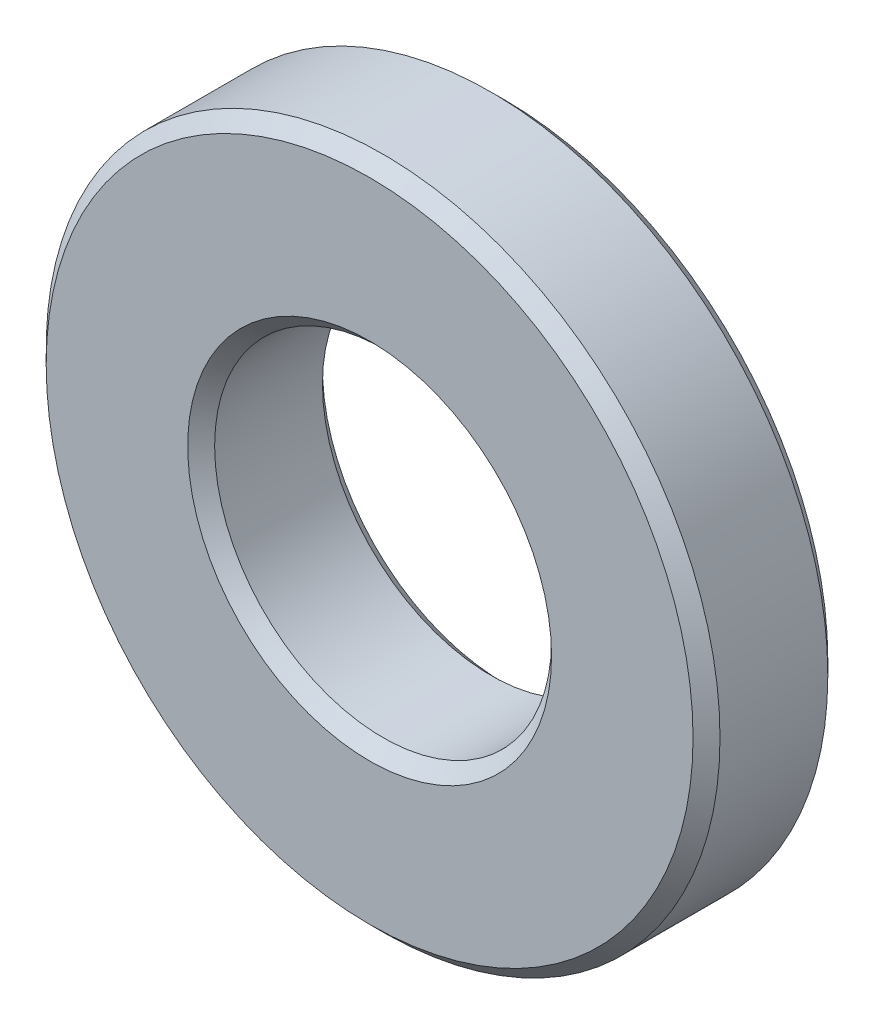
SolidWorks part; units mm, degrees
ref_plane "Front Plane" through (0, 0, 0) normal (0, 0, 1) x (1, 0, 0)
ref_plane "Top Plane" through (0, 0, 0) normal (0, 1, 0) x (1, 0, 0)
ref_plane "Right Plane" through (0, 0, 0) normal (1, 0, 0) x (0, 0, -1)
sketch "Sketch1" plane through (0, 0, 0) normal (0, 0, 1) x (1, 0, 0)
  circle A0 centre (0, 0) radius 2.5
  circle A1 centre (0, 0) radius 1.25
  dimension "D1" = 5
  dimension "D2" = 2.5
extrude "Boss-Extrude2" add sketch "Sketch1" along normal mid plane 1
chamfer "Chamfer3" distance 0.1 angle 45 4 edges at (2.5, 0, 0.5) (2.5, 0, -0.5) (1.25, 0, -0.5) (1.25, 0, 0.5)
